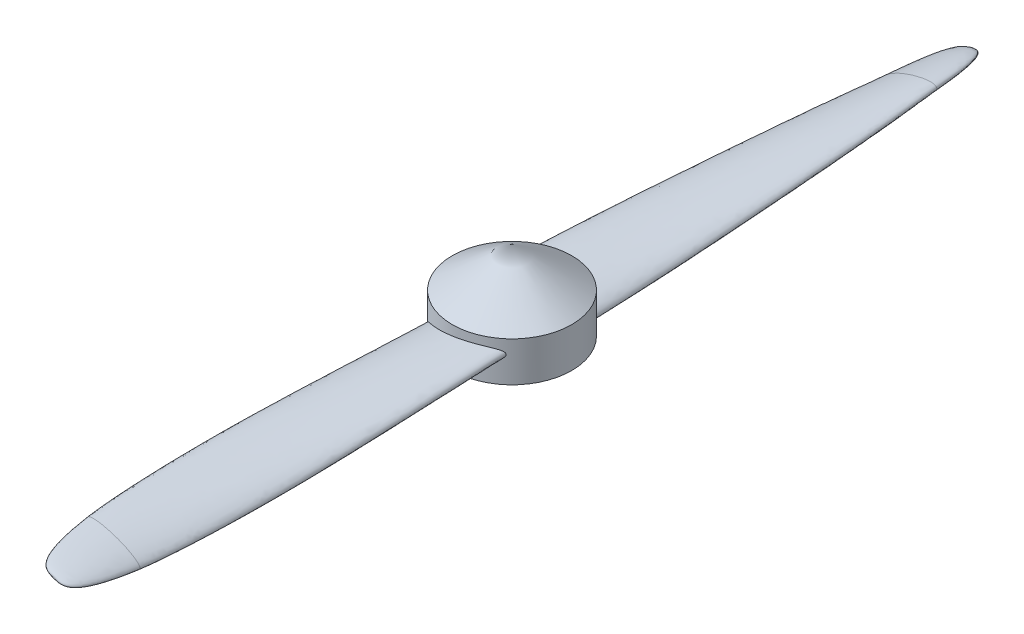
SolidWorks part; units mm, degrees
ref_plane "Plan de face" through (0, 0, 0) normal (0, 0, 1) x (1, 0, 0)
ref_plane "Plan de dessus" through (0, 0, 0) normal (0, 1, 0) x (1, 0, 0)
ref_plane "Plan de droite" through (0, 0, 0) normal (1, 0, 0) x (0, 0, -1)
ref_plane "plan fin pale" through (0, 0, 115) normal (0, 0, 1) x (1, 0, 0)
sketch "Esquisse1" plane through (0, 0, 0) normal (0, 0, 1) x (1, 0, 0)
  ellipse E0 centre (0, 0) end of major axis (10, 0) minor radius 2.5
  dimension "D1" = 20
  dimension "D2" = 5
sketch "Esquisse2" plane through (0, 0, 115) normal (0, 0, 1) x (1, 0, 0)
  point P0 (0, 0)
loft "pale plate" add profiles "Esquisse1", "Esquisse2"
other "pas sens anti horaire" [suppressed] parameters "D0"=30, "D1"=10, "D2"=0
other "pas sens horaire" parameters "D0"=30, "D1"=10, "D2"=0
sketch "Esquisse3" plane through (0, 0, 0) normal (0, 1, 0) x (1, 0, 0)
  circle A0 centre (0, 0) radius 15
  dimension "D1" = 30
extrude "moyeu" add sketch "Esquisse3" along normal mid plane 10
pattern_circular "obtention pale sup'" count 2 over 360 about axis through (0, 5, 0) along (0, -1, 0) of "pale plate"
sketch "Esquisse4" plane through (0, 0, 0) normal (0, 0, 1) x (1, 0, 0)
  line L0 (0, 18.965) -> (0, -9.9642) construction
  line L1 (0, 15) -> (0, 5)
  line L2 (15, 5) -> (-15, 5) construction
  line L3 (0, 5) -> (15, 5)
  line L4 (15, 5) -> (0, 15)
  dimension "D1" = 10
revolve "cône" add sketch "Esquisse4" angle 360 about L0
sketch "Esquisse5" plane through (0, -5, 0) normal (0, -1, 0) x (1, 0, 0)
  circle A0 centre (0, 0) radius 2.5
  dimension "D1" = 5
extrude "passage axe" cut sketch "Esquisse5" against normal offset from surface (17.1315 mm away) 1
